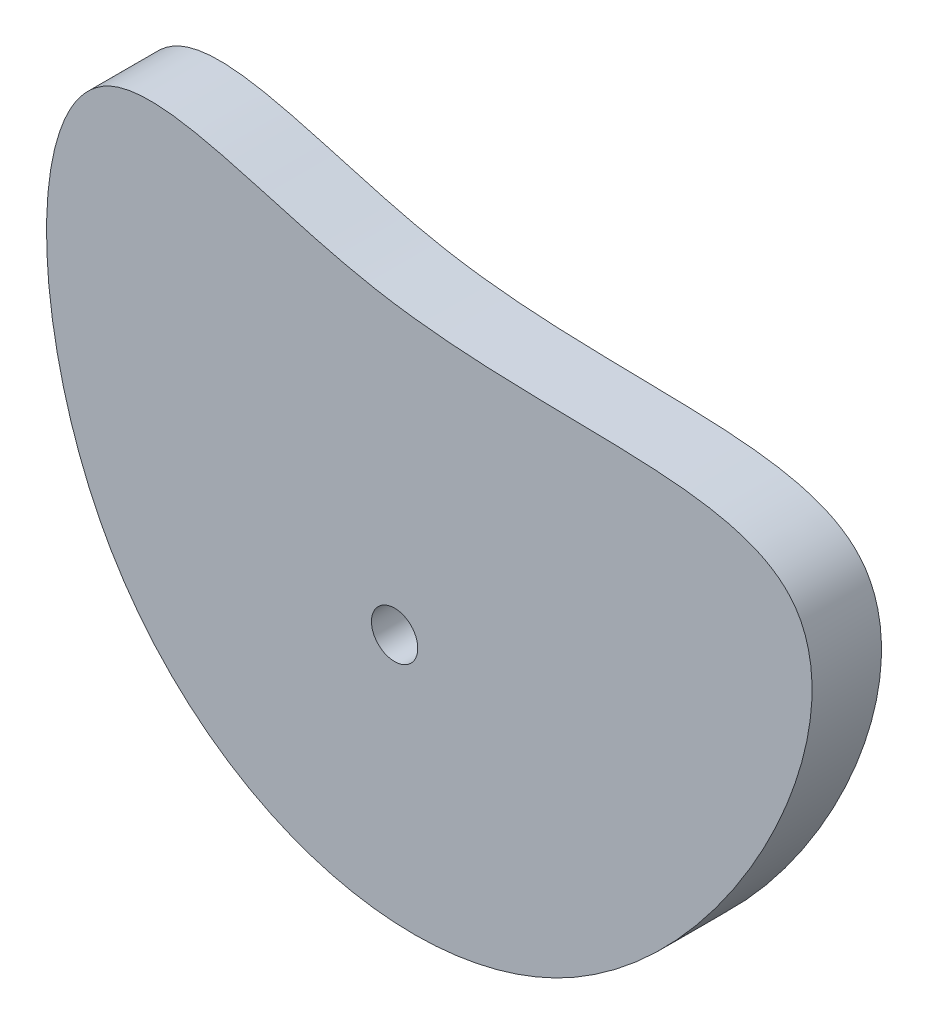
SolidWorks part; units mm, degrees
ref_plane "Front Plane" through (0, 0, 0) normal (0, 0, 1) x (1, 0, 0)
ref_plane "Top Plane" through (0, 0, 0) normal (0, 1, 0) x (1, 0, 0)
ref_plane "Right Plane" through (0, 0, 0) normal (1, 0, 0) x (0, 0, -1)
sketch "Sketch1" plane through (0, 0, 0) normal (0, 0, 1) x (1, 0, 0)
  circle A0 centre (0, 0) radius 6.35
  circle A1 centre (0, 0) radius 31.75
  dimension "D1" = 12.7
  dimension "D2" = 25.4
extrude "Extrude1" add sketch "Sketch1" along normal blind 19.05
sketch "Sketch2" plane through (0, 0, 19.05) normal (0, 0, 1) x (1, 0, 0)
  circle A0 centre (0, 0) radius 6.35 construction
  circle A1 centre (0, 0) radius 6.35
  spline S0 degree 3 poles (-102.523, 118.9881) (7.8964, 63.1735) (156.3115, 96.6805) (59.5568, -101.2237) (-98.512, -48.9827) (-102.523, 118.9881) (7.8964, 63.1735) (156.3115, 96.6805) knots -0.557826 -0.319442 -0.131654 0 0.206405 0.442174 0.680558 0.868346 1 1.206405 1.442174 1.680558 only from (-5.3056, 79.5437) to (-5.3056, 79.5437)
extrude "Extrude2" add sketch "Sketch2" against normal up to surface (19.05 mm away)
